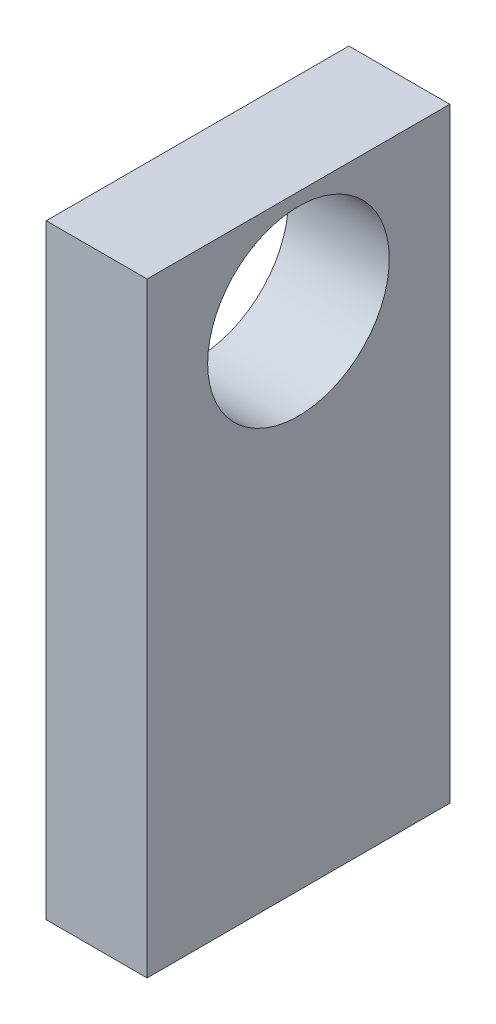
SolidWorks part; units mm, degrees
ref_plane "Front Plane" through (0, 0, 0) normal (0, 0, 1) x (1, 0, 0)
ref_plane "Top Plane" through (0, 0, 0) normal (0, 1, 0) x (1, 0, 0)
ref_plane "Right Plane" through (0, 0, 0) normal (1, 0, 0) x (0, 0, -1)
sketch "Sketch1" plane through (0, 0, 0) normal (0, 1, 0) x (1, 0, 0)
  line L1 (-3.175, -9.525) -> (3.175, -9.525)
  line L2 (-3.175, -9.525) -> (-3.175, 9.525)
  line L3 (-3.175, 9.525) -> (3.175, 9.525)
  line L4 (3.175, -9.525) -> (3.175, 9.525)
  line L5 (-3.175, -9.525) -> (3.175, 9.525) construction
  line L6 (-3.175, 9.525) -> (3.175, -9.525) construction
  point P0 (0, 0)
  dimension "D1" = 6.35
  dimension "D2" = 19.05
extrude "Boss-Extrude1" add sketch "Sketch1" along normal blind 38.1
sketch "Sketch2" plane through (3.175, 0, 0) normal (1, 0, 0) x (0, 0, -1)
  circle A0 centre (0, 31.5813) radius 5.715
  dimension "D1" = 11.43
extrude "Cut-Extrude1" cut sketch "Sketch2" against normal up to next
